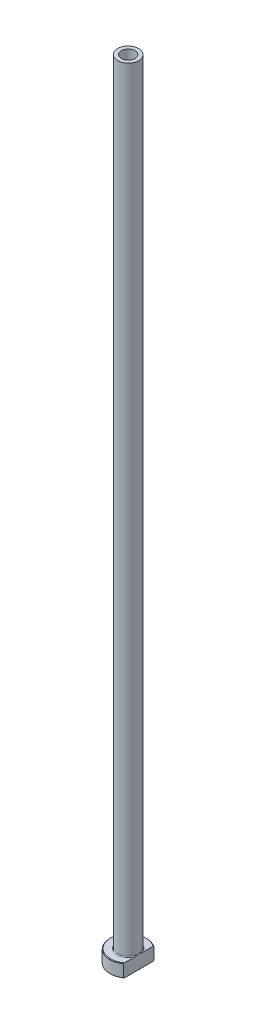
SolidWorks part; units mm, degrees
ref_plane "Front Plane" through (0, 0, 0) normal (0, 0, 1) x (1, 0, 0)
ref_plane "Top Plane" through (0, 0, 0) normal (0, 1, 0) x (1, 0, 0)
ref_plane "Right Plane" through (0, 0, 0) normal (1, 0, 0) x (0, 0, -1)
sketch "Sketch1" plane through (0, 0, 0) normal (0, 0, 1) x (1, 0, 0)
  line L0 (-2.6, 300) -> (-4, 300)
  line L1 (-4, 300) -> (-4, 5)
  line L2 (-4, 5) -> (-7, 5)
  line L3 (-7, 5) -> (-7, 0)
  line L4 (6.05, 0) -> (-6.05, 0) construction
  line L5 (-7, 0) -> (-2.85, 0)
  line L6 (-2.6, 255) -> (-2.6, 300)
  line L7 (0, 92.1877) -> (0, -15.5353) construction
  line L8 (0, -7.7) -> (0, 7.7) construction
  line L9 (-2.6, 255) -> (-2.85, 243)
  line L10 (-2.85, 243) -> (-2.85, 0)
  dimension "D1" = 0.25
  dimension "ID" = 5.2
  dimension "OD" = 8
  dimension "L" = 300
  dimension "H" = 14
  dimension "T" = 5
  dimension "N" = 45
  dimension "D2" = 12
  dimension "L-N" = 255
revolve "Revolve1" add sketch "Sketch1" angle 360 about L7
fillet "Fillet1" radius 0.3 1 edges at (0, 5, 4)
chamfer "Chamfer1" distance 0.2 angle 45 2 edges at (0, 5, 7) (0, 0, 7)
sketch "Sketch2" plane through (0, 0, 0) normal (0, -1, 0) x (1, 0, 0)
  line L0 (4, 5.7446) -> (4, -5.7446)
  circle A0 centre (0, 0) radius 7 construction
  arc A1 (4, 5.7446) -> (4, -5.7446) centre (0, 0) cw
  circle A2 centre (0, 0) radius 4 construction
extrude "Cut-Extrude1" cut sketch "Sketch2" against normal through all
chamfer "Chamfer2" distance 0.5 angle 45 1 edges at (0, 0, 2.85)
